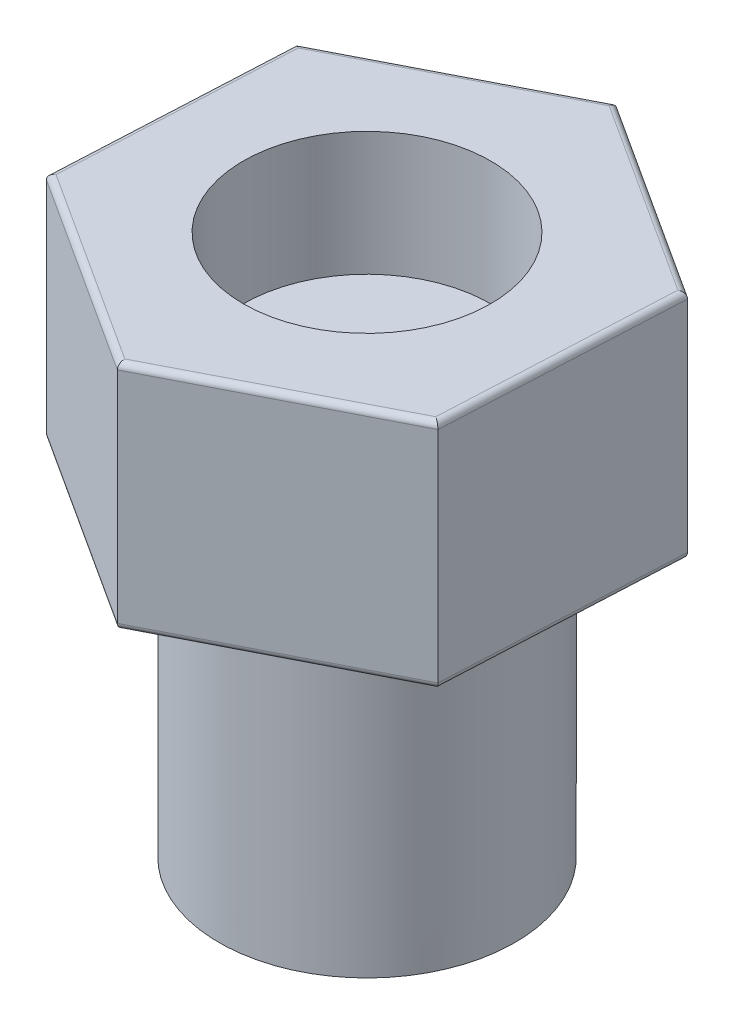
SolidWorks part; units mm, degrees
ref_plane "Front Plane" through (0, 0, 0) normal (0, 0, 1) x (1, 0, 0)
ref_plane "Top Plane" through (0, 0, 0) normal (0, 1, 0) x (1, 0, 0)
ref_plane "Right Plane" through (0, 0, 0) normal (1, 0, 0) x (0, 0, -1)
sketch "Sketch1" plane through (0, 0, 0) normal (0, 1, 0) x (1, 0, 0)
  line L1 (12.3207, -7.9532) -> (13.048, 6.6935)
  line L2 (13.048, 6.6935) -> (0.7273, 14.6466)
  line L3 (0.7273, 14.6466) -> (-12.3207, 7.9532)
  line L4 (-12.3207, 7.9532) -> (-13.048, -6.6935)
  line L5 (-13.048, -6.6935) -> (-0.7273, -14.6466)
  line L6 (-0.7273, -14.6466) -> (12.3207, -7.9532)
  circle A0 centre (0, 0) radius 12.7 construction
  dimension "D1" = 25.4
extrude "Boss-Extrude1" add sketch "Sketch1" along normal blind 14.2748
fillet "Fillet1" radius 0.381 12 edges at (12.6844, 0, 0.6299) (6.8877, 0, -10.6701) (-5.7967, 0, -11.2999) (-12.6844, 0, -0.6299) (-6.8877, 0, 10.6701) (5.7967, 0, 11.2999) (-6.8877, 14.2748, 10.6701) (-12.6844, 14.2748, -0.6299) (-5.7967, 14.2748, -11.2999) (6.8877, 14.2748, -10.6701) (12.6844, 14.2748, 0.6299) (5.7967, 14.2748, 11.2999)
sketch "Sketch2" plane through (0, 0, 0) normal (0, -1, 0) x (1, 0, 0)
  circle A0 centre (0, 0) radius 9.1186
  dimension "D1" = 18.2372
extrude "Boss-Extrude2" add sketch "Sketch2" along normal blind 19.05 draft 0.02
sketch "Sketch3" plane through (0, -19.05, 0) normal (0, -1, 0) x (1, 0, 0)
  circle A0 centre (0, 0) radius 6.35
  dimension "D1" = 12.7
extrude "Cut-Extrude1" cut sketch "Sketch3" against normal blind 20.32
sketch "Sketch4" plane through (0, 14.2748, 0) normal (0, 1, 0) x (1, 0, 0)
  circle A0 centre (0, 0) radius 7.62
  dimension "D1" = 15.24
extrude "Cut-Extrude2" cut sketch "Sketch4" against normal blind 7.62
